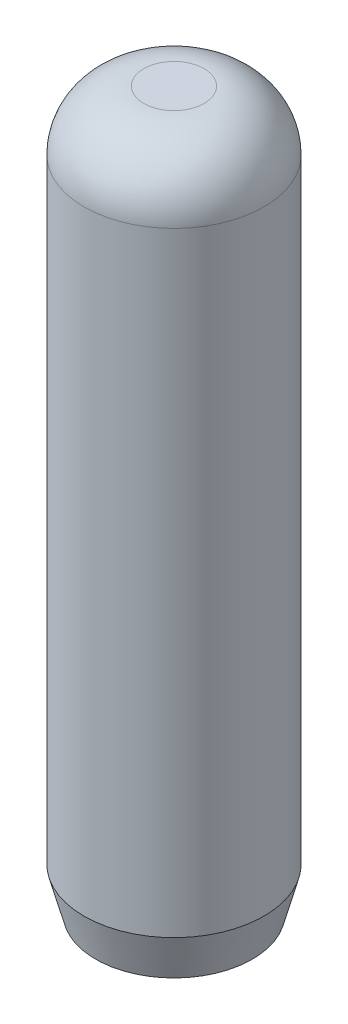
SolidWorks part; units mm, degrees
ref_plane "Front x-y" through (0, 0, 0) normal (0, 0, 1) x (1, 0, 0)
ref_plane "Top x-z" through (0, 0, 0) normal (0, 1, 0) x (1, 0, 0)
ref_plane "Side y-z" through (0, 0, 0) normal (1, 0, 0) x (0, 0, -1)
sketch "Sketch1" plane through (0, 0, 0) normal (0, 0, 1) x (1, 0, 0)
  line L0 (0, 0) -> (0, 9.525) construction
  line L1 (0, 0) -> (0, 9.525)
  line L2 (0, 9.525) -> (0.4007, 9.525)
  line L3 (1.1944, 8.7313) -> (1.1944, 0.5721)
  line L4 (1.1944, 0.5721) -> (1.0411, 0)
  line L5 (1.0411, 0) -> (0, 0)
  arc A0 (1.1944, 8.7313) -> (0.4007, 9.525) centre (0.4007, 8.7313) ccw
  dimension "D4" = 1.1944
  dimension "D1" = 0.7937
  dimension "D2" = 9.525
  dimension "D3" = 0.1533
  dimension "D5" = 15
revolve "Base-Revolve" add sketch "Sketch1" angle 360 about L0
